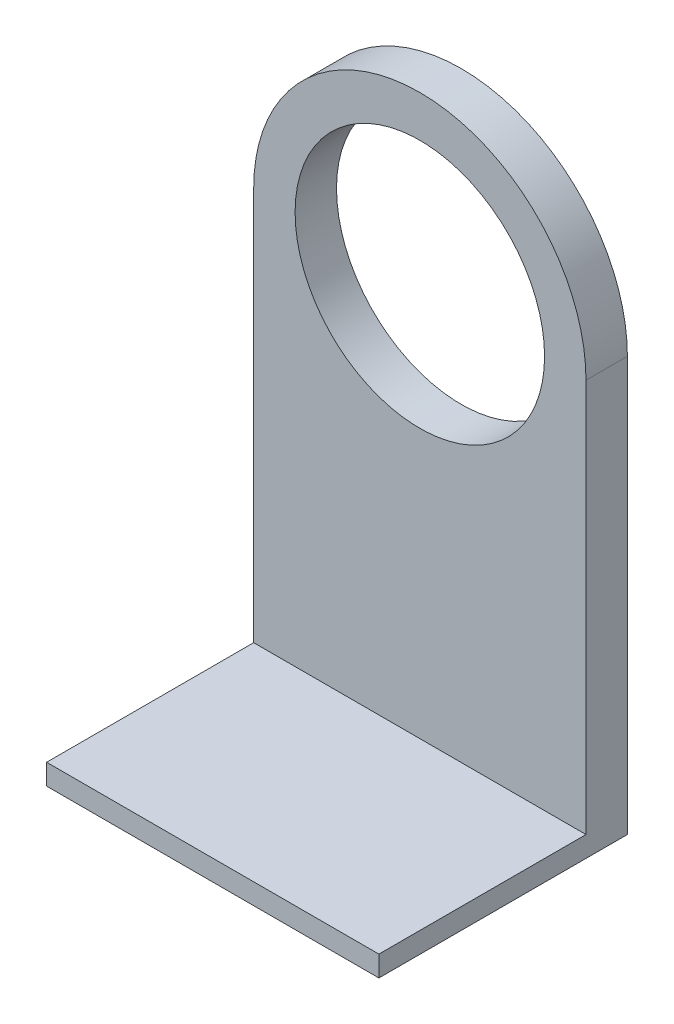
SolidWorks part; units mm, degrees
ref_plane "Front Plane" through (0, 0, 0) normal (0, 0, 1) x (1, 0, 0)
ref_plane "Top Plane" through (0, 0, 0) normal (0, 1, 0) x (1, 0, 0)
ref_plane "Right Plane" through (0, 0, 0) normal (1, 0, 0) x (0, 0, -1)
sketch "Sketch1" plane through (0, 0, 0) normal (0, 0, 1) x (1, 0, 0)
  line L0 (50.95, 0) -> (50.95, -127)
  line L1 (50.95, -127) -> (-50.95, -127)
  line L2 (-50.95, 0) -> (-50.95, -127)
  circle A0 centre (0, 0) radius 38.25
  arc A1 (50.95, 0) -> (-50.95, 0) centre (0, 0) ccw
  circle A2 centre (0, 0) radius 50.95 construction
  dimension "D1" = 76.5
  dimension "D3" = 127
  dimension "D2" = 12.7
extrude "Extrude1" add sketch "Sketch1" along normal blind 12.7
sketch "Sketch2" plane through (0, 0, 12.7) normal (0, 0, 1) x (1, 0, 0)
  line L0 (-50.95, -127) -> (50.95, -127) construction
  line L1 (-50.95, -127) -> (50.95, -127)
  line L2 (-50.95, -120.65) -> (50.95, -120.65)
  line L3 (50.95, -127) -> (50.95, 0) construction
  line L4 (50.95, -127) -> (50.95, -120.65)
  line L5 (-50.95, 0) -> (-50.95, -127) construction
  line L6 (-50.95, -120.65) -> (-50.95, -127)
  dimension "D1" = 6.35
extrude "Extrude2" add sketch "Sketch2" along normal blind 63.5
